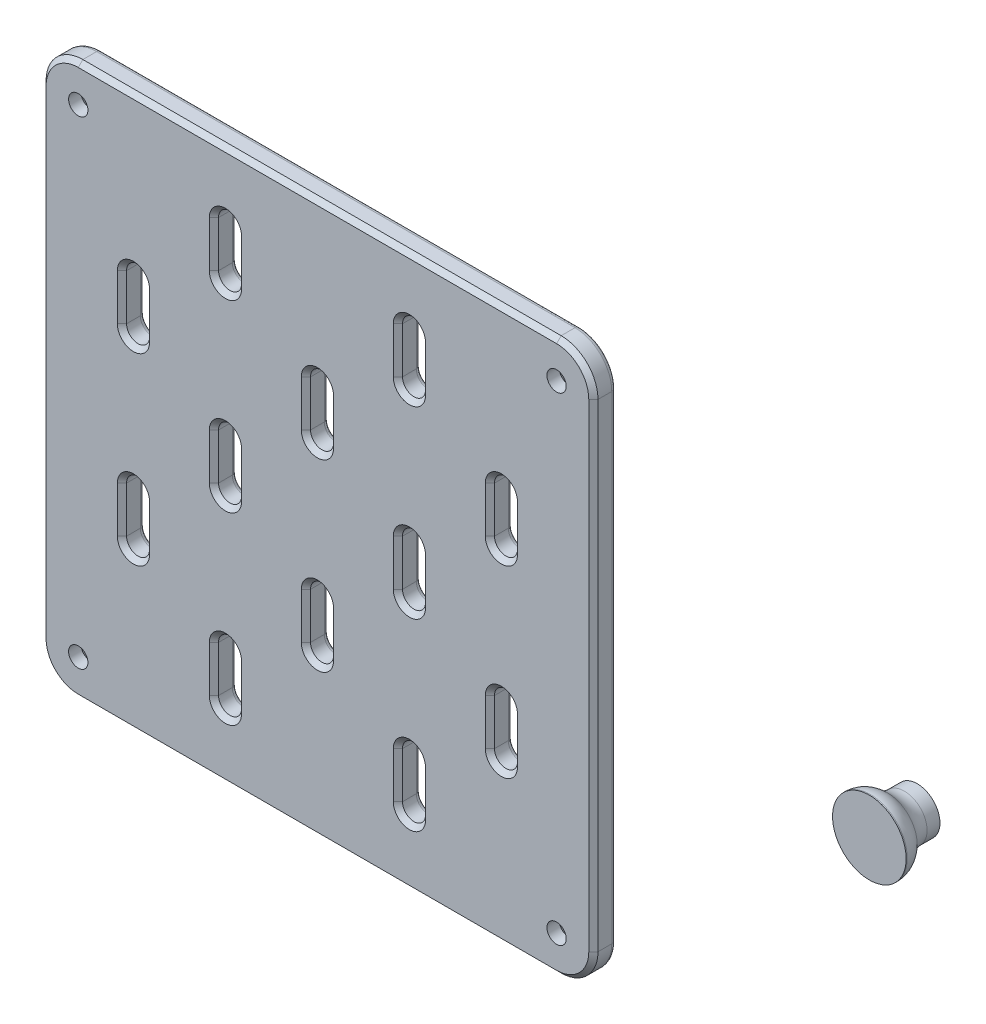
SolidWorks part; units mm, degrees
ref_plane "Спереди" through (0, 0, 0) normal (0, 0, 1) x (1, 0, 0)
ref_plane "Сверху" through (0, 0, 0) normal (0, 1, 0) x (1, 0, 0)
ref_plane "Справа" through (0, 0, 0) normal (1, 0, 0) x (0, 0, -1)
other "Configuration Table"
sketch "Эскиз1" plane through (0, 0, 0) normal (0, 0, 1) x (1, 0, 0)
  line L1 (-60, 60) -> (60, 60)
  line L2 (-60, 60) -> (-60, -60)
  line L3 (-60, -60) -> (60, -60)
  line L4 (60, 60) -> (60, -60)
  point P4 (0, 60)
  point P6 (-60, 0)
extrude "Бобышка-Вытянуть1" add sketch "Эскиз1" against normal blind 5 contours L1 L4 L3 L2
sketch "Эскиз2" plane through (0, 0, -5) normal (0, 0, -1) x (-1, 0, 0)
  line L0 (-42.5, 15) -> (-42.5, 25)
  line L1 (-37.5, 25) -> (-37.5, 15)
  line L2 (-42.5, 20) -> (-37.5, 20) construction
  line L3 (-40, 27.5) -> (-40, 12.5) construction
  line L5 (60, 60) -> (-60, 60) construction
  line L6 (-60, 60) -> (-60, -60) construction
  arc A0 (-42.5, 25) -> (-37.5, 25) centre (-40, 25) cw
  arc A1 (-37.5, 15) -> (-42.5, 15) centre (-40, 15) cw
extrude "Вырез-Вытянуть1" cut sketch "Эскиз2" against normal up to surface (5 mm away)
pattern_linear "Линейный массив5" [suppressed] count 3 spacing 40
pattern_linear "Линейный массив1" count 2 spacing 40 along (0, -1, 0) of "Вырез-Вытянуть1"
pattern_linear "Линейный массив2" count 3 spacing 40 along (-1, 0, 0) of "Линейный массив1", "Вырез-Вытянуть1"
sketch "Эскиз4" plane through (0, 0, -5) normal (0, 0, -1) x (-1, 0, 0)
  line L0 (-22.5, 35) -> (-22.5, 45)
  line L1 (-17.5, 45) -> (-17.5, 35)
  line L2 (-22.5, 40) -> (-17.5, 40) construction
  line L3 (-20, 47.5) -> (-20, 32.5) construction
  line L4 (60, 60) -> (-60, 60) construction
  line L5 (-40, 27.5) -> (-40, 12.5) construction
  arc A0 (-22.5, 45) -> (-17.5, 45) centre (-20, 45) cw
  arc A1 (-17.5, 35) -> (-22.5, 35) centre (-20, 35) cw
  arc A2 (-37.5, 25) -> (-42.5, 25) centre (-40, 25) ccw construction
  arc A3 (-42.5, 15) -> (-37.5, 15) centre (-40, 15) ccw construction
extrude "Вырез-Вытянуть2" cut sketch "Эскиз4" against normal up to surface (5 mm away)
pattern_linear "Линейный массив3" count 3 spacing 40 along (0, -1, 0) of "Вырез-Вытянуть2"
pattern_linear "Линейный массив4" count 2 spacing 40 along (-1, 0, 0) of "Линейный массив3", "Вырез-Вытянуть2"
fillet "Скругление1" radius 8 4 edges at (60, -60, -2.5) (-60, -60, -2.5) (60, 60, -2.5) (-60, 60, -2.5)
fillet "Скругление2" radius 1 56 edges at (20, 47.5, -5) (22.5, 40, -5) (20, 32.5, -5) (17.5, 40, -5) (22.5, 0, -5) (20, -7.5, -5) (17.5, 0, -5) (20, 7.5, -5) (22.5, -40, -5) (20, -32.5, -5) (17.5, -40, -5) (20, -47.5, -5) (-20, 47.5, -5) (-17.5, 40, -5) (-20, 32.5, -5) (-22.5, 40, -5) (-20, 7.5, -5) (-17.5, 0, -5) (-20, -7.5, -5) (-22.5, 0, -5) (-20, -32.5, -5) (-17.5, -40, -5) (-20, -47.5, -5) (-22.5, -40, -5) (0, -60, -5) (40, 27.5, -5) (60, 0, -5) (42.5, 20, -5) (-60, 0, -5) (0, 60, -5) (-57.6569, 57.6569, -5) (40, 12.5, -5) (57.6569, 57.6569, -5) (-57.6569, -57.6569, -5) (57.6569, -57.6569, -5) (37.5, 20, -5) (40, -12.5, -5) (42.5, -20, -5) (40, -27.5, -5) (37.5, -20, -5) (0, 27.5, -5) (2.5, 20, -5) (0, 12.5, -5) (-2.5, 20, -5) (0, -12.5, -5) (2.5, -20, -5) (0, -27.5, -5) (-2.5, -20, -5) (-40, 27.5, -5) (-37.5, 20, -5) (-40, 12.5, -5) (-42.5, 20, -5) (-40, -12.5, -5) (-37.5, -20, -5) (-40, -27.5, -5) (-42.5, -20, -5)
chamfer "Фаска1" distance 1 angle 45 56 edges at (22.5, 40, 0) (20, 32.5, 0) (17.5, 40, 0) (20, 47.5, 0) (22.5, 0, 0) (20, -7.5, 0) (17.5, 0, 0) (20, 7.5, 0) (22.5, -40, 0) (20, -47.5, 0) (17.5, -40, 0) (20, -32.5, 0) (-17.5, 40, 0) (-20, 32.5, 0) (-22.5, 40, 0) (-20, 47.5, 0) (-17.5, 0, 0) (-20, -7.5, 0) (-22.5, 0, 0) (-20, 7.5, 0) (-17.5, -40, 0) (-20, -47.5, 0) (-22.5, -40, 0) (-20, -32.5, 0) (0, -60, 0) (-60, 0, 0) (60, 0, 0) (0, 60, 0) (-57.6569, 57.6569, 0) (57.6569, 57.6569, 0) (-57.6569, -57.6569, 0) (57.6569, -57.6569, 0) (42.5, 20, 0) (40, 12.5, 0) (37.5, 20, 0) (40, 27.5, 0) (42.5, -20, 0) (40, -27.5, 0) (37.5, -20, 0) (40, -12.5, 0) (2.5, 20, 0) (0, 12.5, 0) (-2.5, 20, 0) (0, 27.5, 0) (2.5, -20, 0) (0, -27.5, 0) (-2.5, -20, 0) (0, -12.5, 0) (-37.5, 20, 0) (-40, 12.5, 0) (-42.5, 20, 0) (-40, 27.5, 0) (-37.5, -20, 0) (-40, -27.5, 0) (-42.5, -20, 0) (-40, -12.5, 0)
sketch "Эскиз5" plane through (0, 0, -5) normal (0, 0, -1) x (-1, 0, 0)
  circle A0 centre (52, 52) radius 2
  arc A1 (59, 52) -> (52, 59) centre (52, 52) ccw construction
hole_wizard "Зенковка для винта с полупотайной головкой M41" positions "Эскиз6" profile "Эскиз7" countersink size "M4" standard "ISO"
sketch "Эскиз6" plane through (0, 0, -5) normal (0, 0, -1) x (-1, 0, 0)
  point P0 (52, 52)
sketch "Эскиз7" plane through (-52, 52, -5) normal (1, 0, 0) x (0, 1, 0)
  line L0 (0, 0) -> (0, 5)
  line L1 (0, 5) -> (2.1, 5)
  line L2 (2.1, 5) -> (2.1, 2.3177)
  line L3 (2.1, 2.3177) -> (4.5, 0)
  line L5 (4.5, 0) -> (0, 0)
  line L6 (-2.1, 2.3177) -> (-4.5, 0) construction
  line L11 (0, -6.35) -> (0, 107.95) construction
  dimension "Диаметр сквозного отверстия" = 4.2
  dimension "Глубина сквозного отверстия" = 5
  dimension "Диаметр передней зенковки" = 9
  dimension "Угол передней зенковки" = 92
mirror "Зеркальное отражение1" about plane through (0, 0, 0) normal (1, 0, 0) of "Зенковка для винта с полупотайной головкой M41"
sketch "Эскиз8" plane through (0, 0, 0) normal (0, 0, 1) x (1, 0, 0)
  line L0 (0, 0) -> (120, 0) construction
sketch "Эскиз10" plane through (0, 0, 0) normal (0, 1, 0) x (1, 0, 0)
  line L0 (120, 0) -> (128, 0)
  line L1 (120, 0) -> (120, 2.4)
  line L2 (120, 2.4) -> (121.95, 2.4)
  line L3 (121.95, 2.4) -> (121.95, 10.4)
  line L4 (121.95, 10.4) -> (124.95, 10.4)
  line L5 (124.95, 10.4) -> (124.95, 5.45)
  line L6 (124.95, 5.45) -> (128, 2.4)
  line L7 (128, 2.4) -> (128, 0)
  line L8 (128, 2.4) -> (128, 5.45) construction
  line L9 (128, 5.45) -> (124.95, 5.45) construction
  line L10 (126.475, 3.925) -> (122.7933, 0.2433) construction
  line L11 (128, 2.4) -> (128, 0.2433) construction
  line L12 (126.475, 3.925) -> (128, 2.4) construction
  line L13 (128, 0.2433) -> (122.7933, 0.2433) construction
  line L14 (128, 2.4) -> (122.7933, 0.2433) construction
revolve "Повернуть1" add sketch "Эскиз10" angle 360 about L1
fillet "Скругление3" radius 5.2067 1 edges at (128, 0, -2.4)
fillet "Скругление4" radius 5.2067 1 edges at (124.95, 0, -5.45)
equation "\"D1@Эскиз1\"=\"Total Length\""
equation "\"D2@Эскиз1\"=\"Total Height\""
equation "\"Between Axis and shift\"= \"Between Axies\" / 2'Don't Touch"
equation "\"Between Axies\"= 40мм'Dont Touch"
equation "\"Fillet\"= 8мм'Don't Touch"
equation "\"Chamfer\"= 1мм'Don't Touch"
equation "\"Panel Thickness\"= 5мм'Dont Touch"
equation "\"Cutout Diameter\"= 5мм'Dont Touch"
equation "\"Cutout Length\"= 15мм'Dont Touch"
equation "\"Number Cutout Horizontal\" = 3"
equation "\"Number Cutout Vertical\" = 2"
equation "\"Total Length\"= \"Between Axis and shift\" * 2 + \"Between Axies\" * ( \"Number Cutout Horizontal\" - 1 )'Don't Touch"
equation "\"Total Height\"= \"Between Axis and shift\" * 2 + \"Between Axies\" * \"Number Cutout Vertical\"'Don't Touch"
equation "\"D1@Бобышка-Вытянуть1\"=\"Panel Thickness\""
equation "\"D1@Эскиз2\"=\"Cutout Diameter\""
equation "\"D2@Эскиз2\"=\"Cutout Length\""
equation "\"D4@Эскиз2\"=\"Between Axis and shift\"+\"Between Axies\"/2"
equation "\"D3@Линейный массив1\"=\"Between Axies\""
equation "\"D1@Линейный массив1\"=\"Number Cutout Vertical\""
equation "\"D1@Линейный массив2\" = \"Number Cutout Horizontal\""
equation "\"D1@Эскиз4\"=\"Cutout Diameter\""
equation "\"D2@Эскиз4\"=\"Cutout Length\""
equation "\"D3@Эскиз4\"=\"Between Axis and shift\""
equation "\"D4@Эскиз4\"=\"Between Axies\"/2"
equation "\"D3@Линейный массив3\"= \"Between Axies\""
equation "\"D1@Линейный массив3\"=\"Number Cutout Vertical\"+1"
equation "\"D3@Линейный массив4\"=\"Between Axies\""
equation "\"D1@Линейный массив4\"=\"Number Cutout Horizontal\"-1"
equation "\"D1@Скругление1\"=\"Fillet\""
equation "\"D1@Скругление2\"=\"Chamfer\""
equation "\"D1@Фаска1\"=\"Chamfer\""
equation "\"D1@Эскиз5\"= 4мм"
equation "\"D1@Эскиз8\"=\"Total Length\""
equation "\"D1@Эскиз10\" = ( \"Screw Diameter\" - \"Clearance\" ) / 2"
equation "\"D2@Эскиз10\"=3мм"
equation "\"D3@Эскиз10\"=\"Bottom Thickness Leg\""
equation "\"D4@Эскиз10\" = \"Screw Length\" - \"Panel Thickness\" + 1"
equation "\"D5@Эскиз10\"=\"Fillet\""
equation "\"Линейный массив1\"= IIF ( \"Number Cutout Vertical\" = 1 , \"suppressed\" , \"unsuppressed\" )"
equation "\"D3@Линейный массив2\"=\"Between Axies\""
equation "\"D3@Линейный массив5\"=\"Between Axies\""
equation "\"D1@Линейный массив5\"=\"Number Cutout Horizontal\""
equation "\"Линейный массив2\"= IIF ( \"Number Cutout Vertical\" = 1 , \"suppressed\" , \"unsuppressed\" )"
equation "\"Линейный массив5\"= IIF ( \"Number Cutout Vertical\" = 1 , \"unsuppressed\" , \"suppressed\" )"
equation "\"Линейный массив4\"= IIF ( ( \"Number Cutout Horizontal\" - 1 ) = 1 , \"suppressed\" , \"unsuppressed\" )"
equation "\"Screw Length\"= 12мм'Which you have"
equation "\"Chamfer leg\"= ( ( ( \"D5@Эскиз10\" - \"D1@Эскиз10\" - \"D2@Эскиз10\" ) * sqr ( 2 ) ) / 2 )'Don't Touch"
equation "\"Bottom Thickness Leg\"= 2.4мм"
equation "\"Compare Fillet Leg\"= IIF ( \"Bottom Thickness Leg\" <= \"Chamfer leg\" , \"Bottom Thickness Leg\" , \"Chamfer leg\" )'Don't Touch"
equation "\"Fillet1\"= \"Compare Fillet Leg\" * cotan ( pi / 8 )'Don't Touch"
equation "\"D1@Скругление3\"=\"Fillet1\""
equation "\"Fillet2\"= ( \"Chamfer leg\" * 2 - \"Compare Fillet Leg\" ) * cotan ( pi / 8 )'Don't Touch"
equation "\"D1@Скругление4\"=\"Fillet2\""
equation "\"D3@Эскиз2\"=\"Between Axis and shift\""
equation "\"Clearance\"= 0.1мм"
equation "\"Screw Diameter\"= 4мм"
